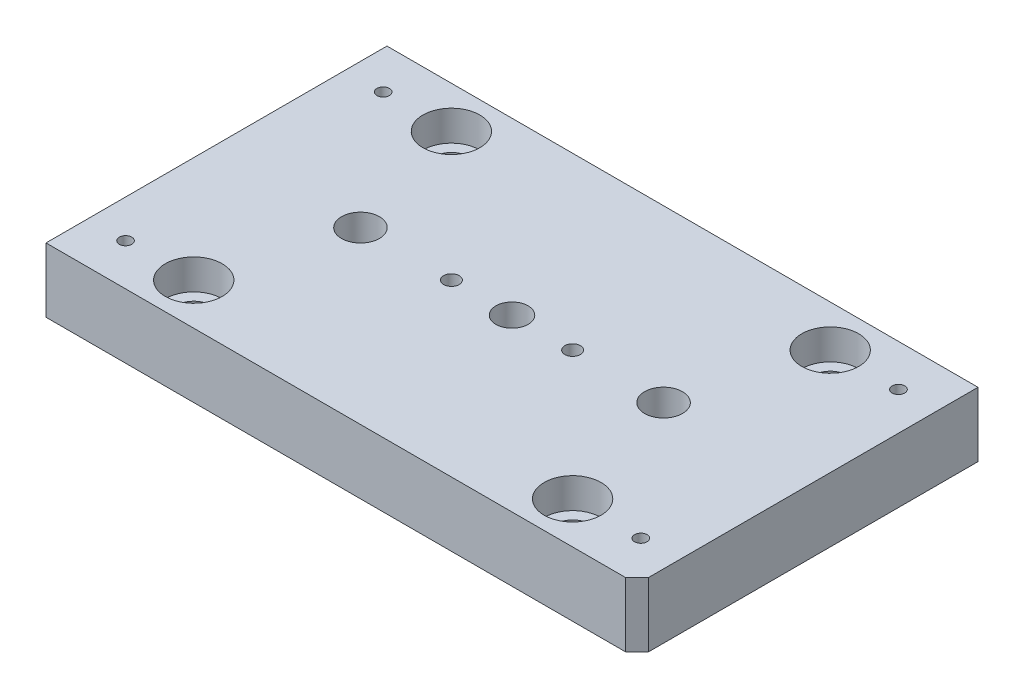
SolidWorks part; units mm, degrees
ref_plane "Plan de face" through (0, 0, 0) normal (0, 0, 1) x (1, 0, 0)
ref_plane "Plan de dessus" through (0, 0, 0) normal (0, 1, 0) x (1, 0, 0)
ref_plane "Plan de droite" through (0, 0, 0) normal (1, 0, 0) x (0, 0, -1)
sketch "Esquisse1" plane through (0, 0, 0) normal (0, 1, 0) x (1, 0, 0)
  line L1 (-78, 45) -> (78, 45)
  line L2 (-78, 45) -> (-78, -45)
  line L3 (-78, -45) -> (78, -45)
  line L4 (78, 45) -> (78, -45)
  point P4 (0, 45)
  point P6 (-78, 0)
  dimension "D1" = 156
  dimension "D2" = 90
extrude "Extrusion1" add sketch "Esquisse1" along normal blind 17
hole_wizard "Trou taraudé M4x0.71" positions "Esquisse3" profile "Esquisse2" tap size "M4x0.7" standard "Ansi Métrique"
sketch "Esquisse3" plane through (0, 17, 0) normal (0, 1, 0) x (-1, 0, 0)
  point P0 (-68, 34)
  point P1 (-68, -34)
  point P3 (68, -34)
  point P5 (68, 34)
  dimension "D1" = 34
  dimension "D2" = 68
  dimension "D3" = 136
  dimension "D4" = 68
sketch "Esquisse2" plane through (68, 17, 34) normal (1, 0, 0) x (0, 0, 1)
  line L0 (0, 0) -> (0, 11.0914)
  line L1 (0, 11.0914) -> (1.65, 10.1)
  line L2 (1.65, 10.1) -> (1.65, 0)
  line L5 (1.65, 0) -> (0, 0)
  line L10 (0, 11.0914) -> (-1.65, 10.1) construction
  line L11 (0, -6.35) -> (0, 107.95) construction
  dimension "Diamètre du trou pour taraudage" = 3.3
  dimension "Profondeur du trou pour taraudage" = 10.1
  dimension "Angle de pointe" = 118
hole_wizard "Chambrage pour vis à tête cylindrique à 6 pans creux (ou vis CHC) M81" positions "Esquisse5" profile "Esquisse4" counterbore size "M8" standard "Ansi Métrique"
sketch "Esquisse5" plane through (0, 17, 0) normal (0, 1, 0) x (-1, 0, 0)
  point P0 (-50, 34)
  point P1 (-50, -34)
  point P3 (50, -34)
  point P5 (50, 34)
  dimension "D1" = 34
  dimension "D2" = 68
  dimension "D3" = 50
  dimension "D4" = 100
sketch "Esquisse4" plane through (50, 17, 34) normal (1, 0, 0) x (0, 0, 1)
  line L0 (0, 0) -> (0, 17)
  line L1 (0, 17) -> (4.5, 17)
  line L3 (4.5, 17) -> (4.5, 8)
  line L4 (4.5, 8) -> (7.5, 8)
  line L5 (7.5, 8) -> (7.5, 0)
  line L7 (7.5, 0) -> (0, 0)
  line L11 (0, -6.35) -> (0, 107.95) construction
  dimension "Diamètre du perçage jusqu'au prochain" = 9
  dimension "Profondeur du perçage jusqu'au prochain" = 17
  dimension "Diamètre du chambrage" = 15
  dimension "Profondeur du chambrage" = 8
sketch "Esquisse6" plane through (0, 17, 0) normal (0, 1, 0) x (-1, 0, 0)
  line L0 (0, 0) -> (-83.2416, 0) construction
  circle A1 centre (-16, 0) radius 2.05
  circle A2 centre (16, 0) radius 2.05
  dimension "D1" = 4.1
  dimension "D4" = 16
  dimension "D5" = 16
extrude "Enlèv. mat.-Extru.1" cut sketch "Esquisse6" against normal through all
hole_wizard "Trou taraudé M10x1.51" positions "Esquisse3D1" profile "Esquisse7" tap size "M10x1.5" standard "Ansi Métrique"
sketch3d "Esquisse3D1"
  point P0 (0, 0, 0)
  point P4 (0, 17, 0)
sketch "Esquisse7" plane through (0, 17, 0) normal (1, 0, 0) x (0, 0, 1)
  line L0 (0, 0) -> (0, 17)
  line L1 (0, 17) -> (4.25, 17)
  line L2 (4.25, 17) -> (4.25, 0)
  line L5 (4.25, 0) -> (0, 0)
  line L11 (0, -6.35) -> (0, 107.95) construction
  dimension "Diamètre du trou pour taraudage jusqu'au prochain" = 8.5
  dimension "Profondeur du trou pour taraudage jusqu'au prochain" = 17
sketch "Esquisse8" plane through (0, 0, 0) normal (0, -1, 0) x (1, 0, 0)
  circle A0 centre (16, 0) radius 4.5
  circle A1 centre (-16, 0) radius 4.5
  dimension "D1" = 9
  dimension "D2" = 9
extrude "Enlèv. mat.-Extru.2" cut sketch "Esquisse8" against normal blind 8
sketch "Esquisse9" plane through (0, 0, 0) normal (0, -1, 0) x (1, 0, 0)
  circle A0 centre (0, 0) radius 6.75
  dimension "D1" = 13.5
extrude "Enlèv. mat.-Extru.5" cut sketch "Esquisse9" against normal blind 4
chamfer "Chanfrein_D" distance 3 angle 45 1 edges at (78, 8.5, 45)
sketch "Esquisse10" plane through (0, 0, 0) normal (0, -1, 0) x (1, 0, 0)
  line L0 (0, 0) -> (100.798, 0) construction
  circle A0 centre (40, 0) radius 5
  circle A1 centre (-40, 0) radius 5
  dimension "D1" = 10
  dimension "D2" = 10
  dimension "D3" = 40
  dimension "D4" = 40
extrude "Enlèv. mat.-Extru.6" cut sketch "Esquisse10" against normal through all
